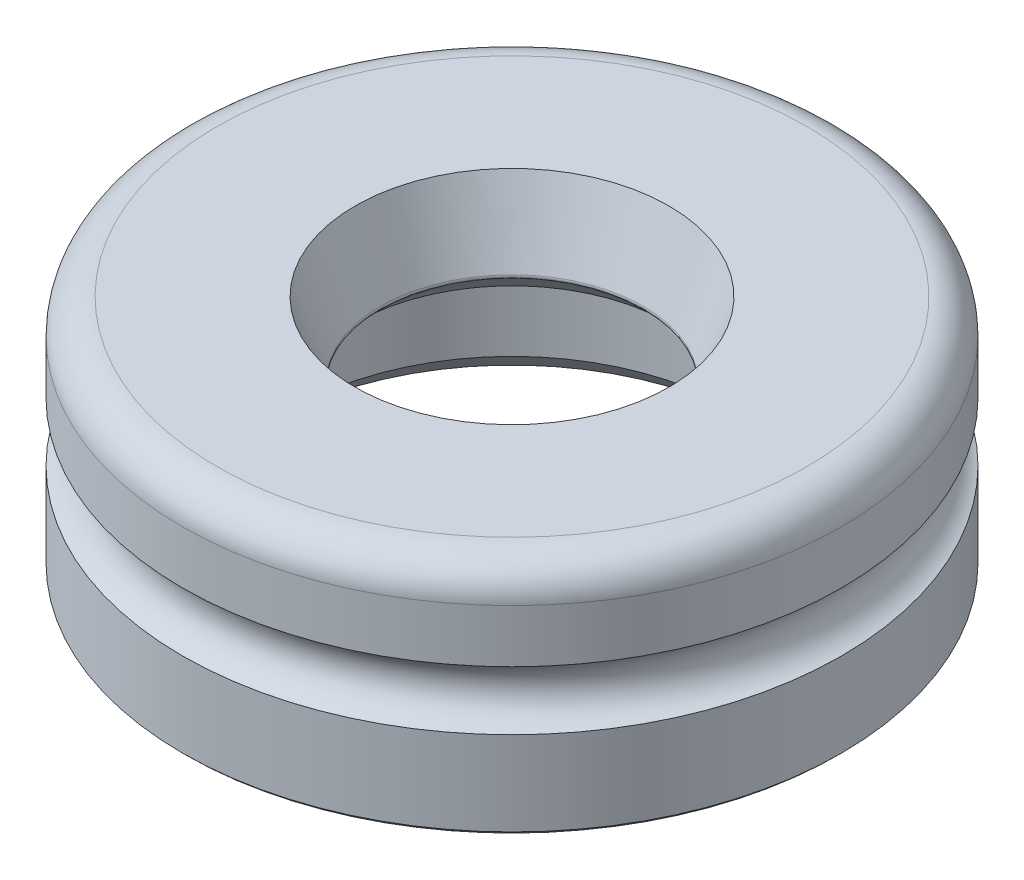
SolidWorks part; units mm, degrees
ref_plane "Plan de face" through (0, 0, 0) normal (0, 0, 1) x (1, 0, 0)
ref_plane "Plan de dessus" through (0, 0, 0) normal (0, 1, 0) x (1, 0, 0)
ref_plane "Plan de droite" through (0, 0, 0) normal (1, 0, 0) x (0, 0, -1)
sketch "Esquisse1" plane through (0, 0, 0) normal (0, 0, 1) x (1, 0, 0)
  line L0 (0, 0) -> (0, 16.8639) construction
  line L1 (-12.75, 0.5) -> (-12.75, 8)
  line L2 (0, 0) -> (-5.8398, 16.96) construction
  line L3 (-9.0511, 14) -> (-7.5345, 9.5954)
  line L4 (-19, 0.5) -> (-12.75, 0.5)
  line L5 (-19, 14) -> (-9.0511, 14)
  line L7 (-12.75, 8) -> (-9.2109, 8)
  line L8 (-19, 0.5) -> (-19, 14)
  arc A0 (-7.5345, 9.5954) -> (-9.2109, 8) centre (0, 0) ccw
  circle A1 centre (0, 0) radius 4 construction
  circle A2 centre (0, 0) radius 12 construction
  dimension "D1" = 8
  dimension "D4" = 24
  dimension "D5" = 12.2
  dimension "D7" = 2
  dimension "D2" = 19
  dimension "D3" = 4
  dimension "D6" = 12.75
  dimension "D8" = 19
  dimension "D9" = 8
  dimension "D10" = 13.5
  dimension "D11" = 0.5
revolve "Révolution1" add sketch "Esquisse1" angle 360 about L0
fillet "Congé1" radius 0.2 2 edges at (0, 9.5954, -7.5345) (0, 8, -9.2109)
fillet "Congé2" radius 2 1 edges at (0, 14, -19)
chamfer "Chanfrein1" distance 1.5 angle 45 1 edges at (0, 0.5, -12.75)
sketch "Esquisse5" plane through (0, 0, 0) normal (0, 0, 1) x (1, 0, 0)
  line L0 (0, 0) -> (0, 25.2514) construction
  line L1 (-17.8, 7.25) -> (0, 7.25) construction
  line L4 (-19, 0.5) -> (19, 0.5) construction
  circle A0 centre (-19.6, 7.25) radius 1.8
  dimension "D1" = 3.6
  dimension "D2" = 35.6
  dimension "D3" = 6.75
revolve "Enlèvement de matière-Révolution1" cut sketch "Esquisse5" angle 360 about L0
ref_plane "Plan1" through (0, 6.25, 0) normal (0, -1, 0) x (1, 0, 0)
chamfer "Chanfrein2" distance 0.2 angle 45 1 edges at (0, 0.5, -19)
